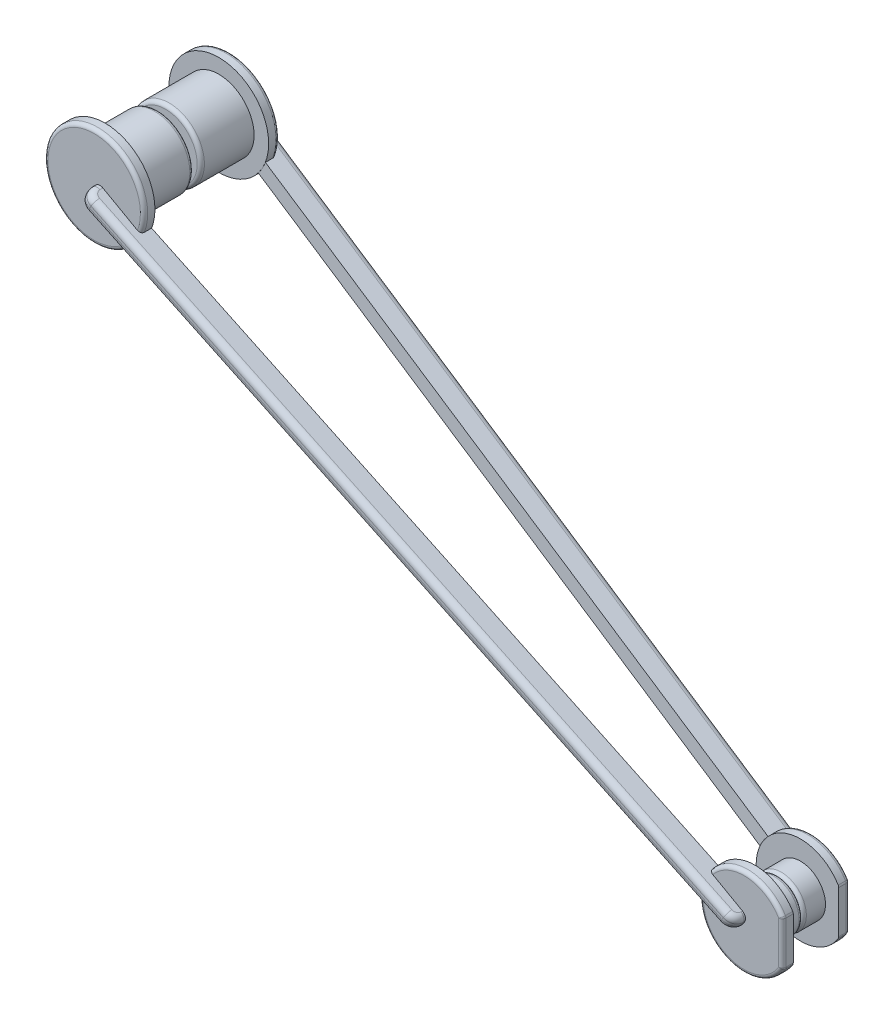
SolidWorks part; units mm, degrees
ref_plane "Front" through (0, 0, 0) normal (0, 0, 1) x (1, 0, 0)
ref_plane "Top" through (0, 0, 0) normal (0, 1, 0) x (1, 0, 0)
ref_plane "Right" through (0, 0, 0) normal (1, 0, 0) x (0, 0, -1)
sketch "Sketch1" plane through (0, 0, 0) normal (0, 0, 1) x (1, 0, 0)
  circle A0 centre (-110.0887, -97.7125) radius 6.9588
  arc A1 (-116.7891, -95.8343) -> (-111.0532, -90.821) centre (-110.0887, -97.7125) ccw construction
extrude "Extrude1" add sketch "Sketch1" along normal blind 1.524
sketch "Sketch2" plane through (0, 0, 0) normal (0, 0, -1) x (-1, 0, 0)
  circle A0 centre (110.0887, -97.7125) radius 4.9268
  arc A1 (110.7715, -92.8333) -> (114.8326, -96.3827) centre (110.0887, -97.7125) ccw construction
extrude "Extrude2" add sketch "Sketch2" along normal up to vertex
sketch "Sketch3" plane through (0, 0, -4.7625) normal (0, 0, 1) x (1, 0, 0)
  line L0 (-18.7836, -152.2336) -> (-18.7836, -139.8664) construction
  line L1 (-18.7836, -149.1568) -> (-18.7836, -142.9432)
  arc A3 (-18.7836, -142.9432) -> (-18.7836, -149.1568) centre (-24.13, -146.05) ccw
extrude "Extrude3" add sketch "Sketch3" along normal blind 1.524
sketch "Sketch4" plane through (0, 0, -4.7625) normal (0, 0, -1) x (-1, 0, 0)
  circle A0 centre (24.13, -146.05) radius 3.4925 construction
  circle A1 centre (24.13, -146.05) radius 3.4925
extrude "Extrude4" add sketch "Sketch4" along normal up to vertex
fillet "Fillet2" radius 0.508 5 edges at (-18.7836, -146.05, -3.2385) (-27.6225, -146.05, -7.9375) (-30.3136, -146.05, -3.2385) (-18.7836, -142.9432, -4.0005) (-18.7836, -149.1568, -4.0005)
ref_plane "Plane1" through (-68.1947, -121.2709, 0) normal (-0.4902, -0.8716, 0) x (0.8716, -0.4902, 0)
sketch "Sketch5" plane through (-68.1947, -121.2709, 0) normal (-0.4902, -0.8716, 0) x (0.8716, -0.4902, 0)
  line L0 (-48.0635, 0.3616) -> (-48.0635, 3.5409)
  line L1 (-48.0635, 1.0795) -> (-48.0635, 0) construction
  line L2 (-48.0635, -7.9375) -> (-48.0635, 0) construction
  line L3 (-48.0635, 3.5409) -> (50.554, -1.5832)
  line L4 (50.554, -7.9375) -> (50.554, -4.7625) construction
  line L5 (50.554, -1.5832) -> (50.554, -4.7625)
  line L6 (47.0615, -4.7625) -> (54.0465, -4.7625) construction
  line L7 (-48.0635, 0.3616) -> (50.554, -4.7625)
  dimension "D1" = 3.175
extrude "Extrude5" add sketch "Sketch5" along normal mid plane 2.032
fillet "Fillet3" radius 1.524 2 edges at (-24.13, -146.05, -1.5832) (-110.0887, -97.7125, 3.5409)
fillet "Fillet4" radius 0.8255 10 edges at (-109.5907, -96.827, 1.7298) (-23.632, -145.1644, -3.1343) (-23.997, -144.9592, -1.9808) (-24.628, -146.9356, -3.1343) (-24.993, -146.7303, -1.9808) (-110.5867, -98.5981, 1.7298) (-66.5424, -121.0344, 0.9747) (-109.1769, -97.0596, 3.0408) (-110.1729, -98.8308, 3.0408) (-67.5384, -122.8056, 0.9747)
mirror "Mirror2" about plane through (-110.0887, -97.7125, -7.9375) normal (0, 0, -1)
ref_plane "Plane2" through (0, 0, -7.4168) normal (0, 0, 1) x (1, 0, 0)
sketch "Sketch6" plane through (0, 0, -7.4168) normal (0, 0, 1) x (1, 0, 0)
  circle A0 centre (-109.9953, -97.5465) radius 7.62
  dimension "D1" = 15.24
extrude "Cut-Extrude1" cut sketch "Sketch6" against normal blind 1.016
fillet "Fillet1" radius 0.508 4 edges at (-116.1542, -94.3017, -17.399) (-105.1619, -97.7125, -7.4168) (-105.1619, -97.7125, -8.4328) (-116.1542, -94.3017, 1.524)
